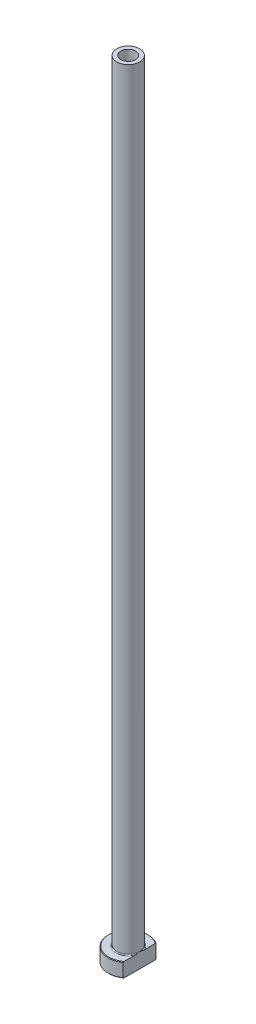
SolidWorks part; units mm, degrees
ref_plane "Front Plane" through (0, 0, 0) normal (0, 0, 1) x (1, 0, 0)
ref_plane "Top Plane" through (0, 0, 0) normal (0, 1, 0) x (1, 0, 0)
ref_plane "Right Plane" through (0, 0, 0) normal (1, 0, 0) x (0, 0, -1)
sketch "Sketch1" plane through (0, 0, 0) normal (0, 0, 1) x (1, 0, 0)
  line L0 (-2.6, 275) -> (-4, 275)
  line L1 (-4, 275) -> (-4, 5)
  line L2 (-4, 5) -> (-7, 5)
  line L3 (-7, 5) -> (-7, 0)
  line L4 (6.05, 0) -> (-6.05, 0) construction
  line L5 (-7, 0) -> (-2.85, 0)
  line L6 (-2.6, 230) -> (-2.6, 275)
  line L7 (0, 92.1877) -> (0, -15.5353) construction
  line L8 (0, -7.7) -> (0, 7.7) construction
  line L9 (-2.6, 230) -> (-2.85, 218)
  line L10 (-2.85, 218) -> (-2.85, 0)
  dimension "D1" = 0.25
  dimension "ID" = 5.2
  dimension "OD" = 8
  dimension "L" = 275
  dimension "H" = 14
  dimension "T" = 5
  dimension "N" = 45
  dimension "D2" = 12
  dimension "L-N" = 230
revolve "Revolve1" add sketch "Sketch1" angle 360 about L7
fillet "Fillet1" radius 0.3 1 edges at (0, 5, 4)
chamfer "Chamfer1" distance 0.2 angle 45 2 edges at (0, 5, 7) (0, 0, 7)
sketch "Sketch2" plane through (0, 0, 0) normal (0, -1, 0) x (1, 0, 0)
  line L0 (4, 5.7446) -> (4, -5.7446)
  circle A0 centre (0, 0) radius 7 construction
  arc A1 (4, 5.7446) -> (4, -5.7446) centre (0, 0) cw
  circle A2 centre (0, 0) radius 4 construction
extrude "Cut-Extrude1" cut sketch "Sketch2" against normal through all
chamfer "Chamfer2" distance 0.5 angle 45 1 edges at (0, 0, 2.85)
